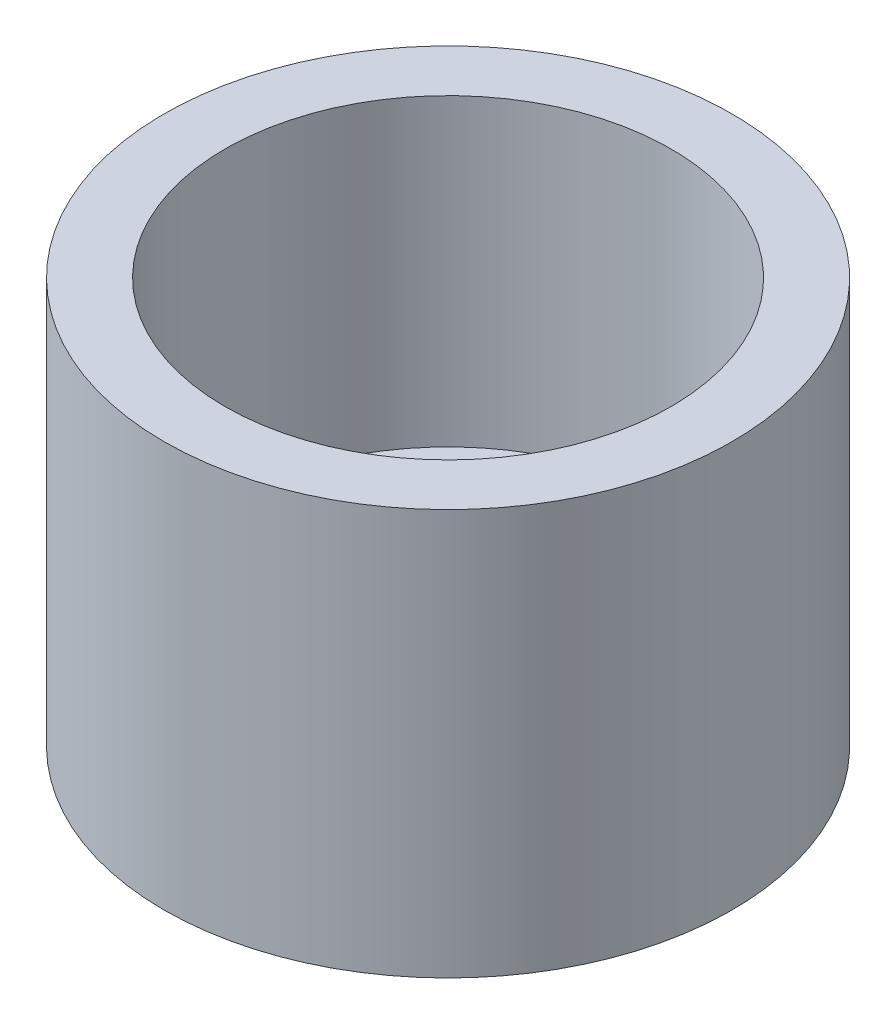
SolidWorks part; units mm, degrees
ref_plane "Front Plane" through (0, 0, 0) normal (0, 0, 1) x (1, 0, 0)
ref_plane "Top Plane" through (0, 0, 0) normal (0, 1, 0) x (1, 0, 0)
ref_plane "Right Plane" through (0, 0, 0) normal (1, 0, 0) x (0, 0, -1)
sketch "Sketch1" plane through (0, 0, 0) normal (0, 1, 0) x (1, 0, 0)
  circle A0 centre (0, 0) radius 7
  dimension "D1" = 14
extrude "Boss-Extrude1" add sketch "Sketch1" along normal blind 10
sketch "Sketch2" plane through (0, 10, 0) normal (0, 1, 0) x (1, 0, 0)
  circle A0 centre (0, 0) radius 5.5
  dimension "D1" = 11
extrude "Cut-Extrude1" cut sketch "Sketch2" against normal blind 7.5
